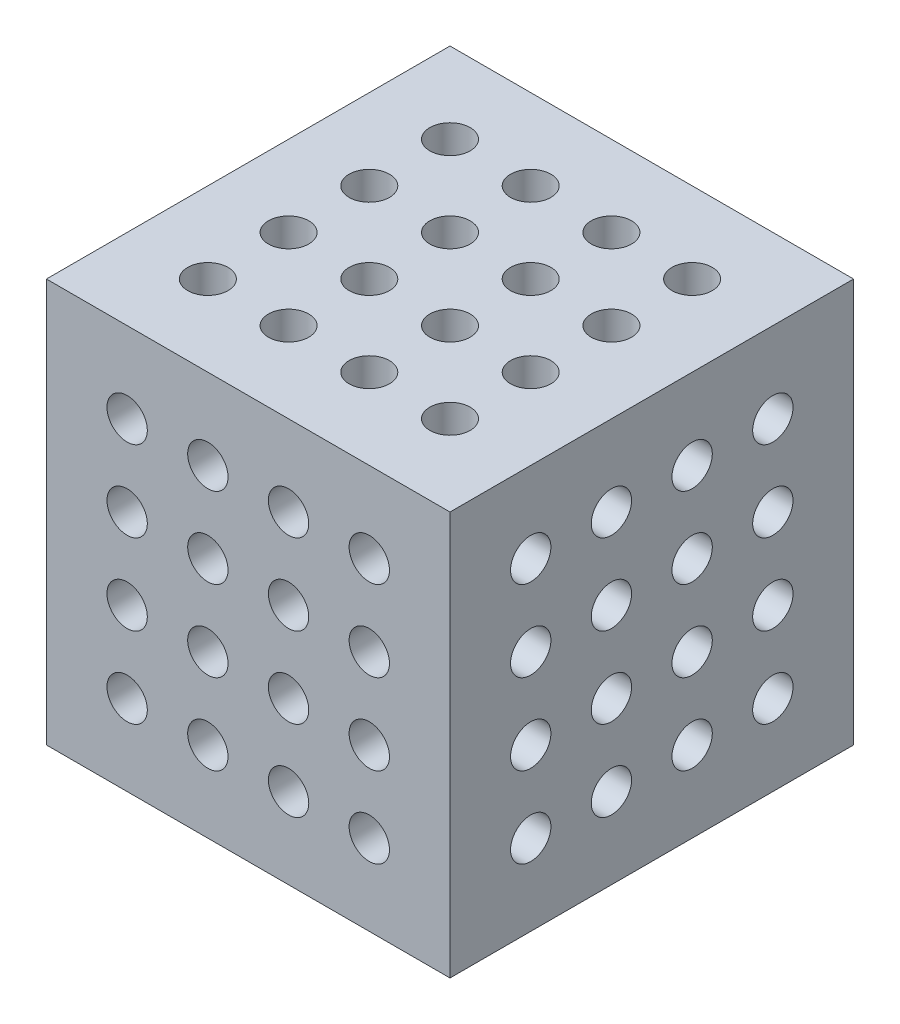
SolidWorks part; units mm, degrees
ref_plane "Ebene vorne" through (0, 0, 0) normal (0, 0, 1) x (1, 0, 0)
ref_plane "Ebene oben" through (0, 0, 0) normal (0, 1, 0) x (1, 0, 0)
ref_plane "Ebene rechts" through (0, 0, 0) normal (1, 0, 0) x (0, 0, -1)
sketch "Skizze1" plane through (0, 0, 0) normal (0, 0, 1) x (1, 0, 0)
  line L1 (0, 0) -> (50, 0)
  line L2 (0, 0) -> (0, 50)
  line L3 (0, 50) -> (50, 50)
  line L4 (50, 0) -> (50, 50)
  dimension "D1" = 50
  dimension "D2" = 50
extrude "Linear austragen1" add sketch "Skizze1" along normal blind 50
sketch "Skizze2" plane through (0, 0, 50) normal (0, 0, 1) x (1, 0, 0)
  line L0 (0, 50) -> (0, 0) construction
  line L1 (50, 50) -> (0, 50) construction
  circle A0 centre (10, 40) radius 2.5
  dimension "D2" = 10
  dimension "D3" = 5
  dimension "D1" = 10
extrude "Linear austragen2" cut sketch "Skizze2" against normal blind 5
pattern_linear "Lineares Muster1" count 4 spacing 10 along (1, 0, 0) count 4 spacing 10 along (0, -1, 0) of "Linear austragen2"
sketch "Skizze3" plane through (50, 0, 0) normal (1, 0, 0) x (0, 0, -1)
  line L0 (-50, 0) -> (-50, 50) construction
  line L1 (-50, 50) -> (0, 50) construction
  circle A0 centre (-40, 40) radius 2.5
  dimension "D1" = 10
  dimension "D2" = 10
  dimension "D3" = 5
extrude "Linear austragen3" cut sketch "Skizze3" against normal blind 5
pattern_linear "Lineares Muster2" count 4 spacing 10 along (0, 0, -1) count 4 spacing 10 along (0, -1, 0) of "Linear austragen3"
sketch "Skizze4" plane through (0, 50, 0) normal (0, 1, 0) x (-1, 0, 0)
  line L0 (-50, 50) -> (0, 50) construction
  line L1 (0, 50) -> (0, 0) construction
  circle A0 centre (-10, 40) radius 2.5
  dimension "D1" = 10
  dimension "D2" = 10
  dimension "D3" = 5
extrude "Linear austragen4" cut sketch "Skizze4" against normal blind 5
pattern_linear "Lineares Muster3" count 4 spacing 10 along (0, 0, -1) count 4 spacing 10 along (1, 0, 0) of "Linear austragen4"
